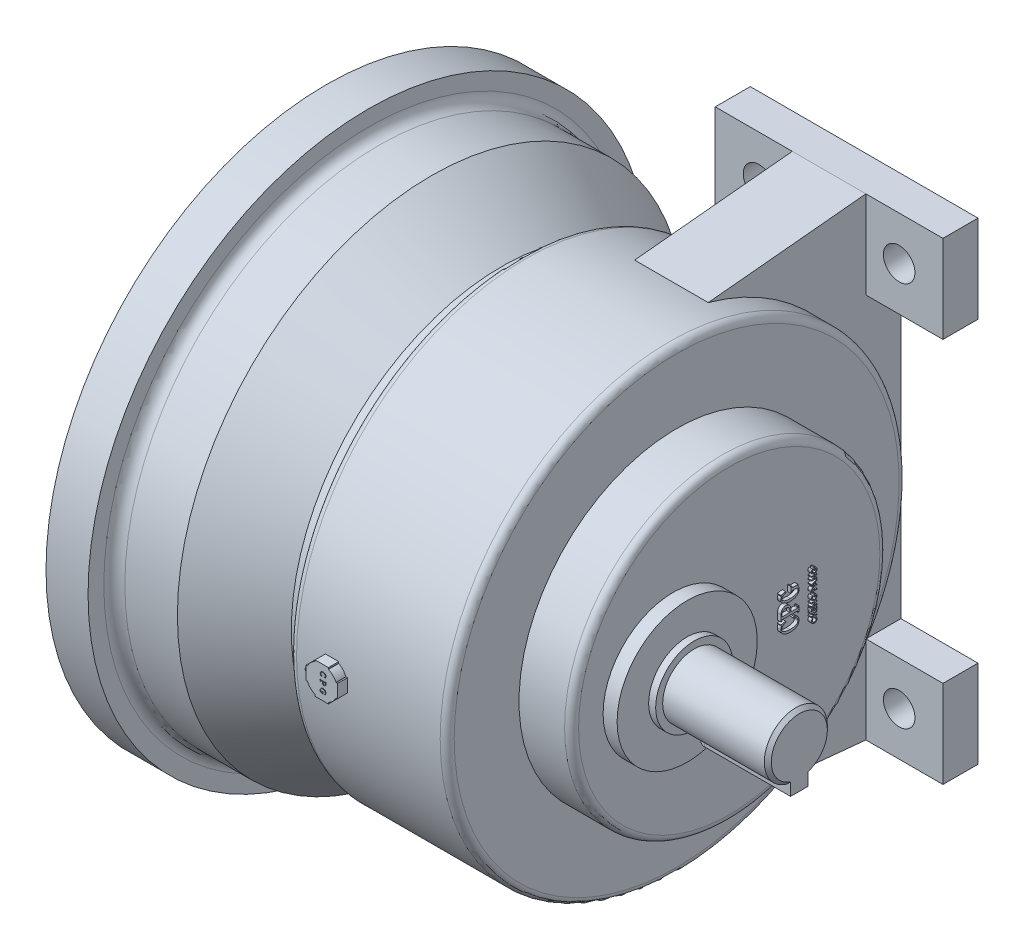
SolidWorks part; units mm, degrees
ref_plane "前视基准面" through (0, 0, 0) normal (0, 0, 1) x (1, 0, 0)
ref_plane "上视基准面" through (0, 0, 0) normal (0, 1, 0) x (1, 0, 0)
ref_plane "右视基准面" through (0, 0, 0) normal (1, 0, 0) x (0, 0, -1)
ref_plane "基准面1" through (0, 0, -88.5) normal (0, 0, 1) x (1, 0, 0)
sketch "草图1" plane through (0, 0, 0) normal (0, 1, 0) x (1, 0, 0)
  line L0 (0, 0) -> (33.1729, 0) construction
  line L1 (0, 0) -> (0, -9)
  line L2 (0, -9) -> (-30, -9)
  line L3 (-30, -9) -> (-30, -11)
  line L4 (-30, -11) -> (-32, -11)
  line L5 (-32, -11) -> (-32, -20)
  line L6 (-32, -20) -> (-36, -20)
  line L7 (-36, -20) -> (-36, 0)
  line L8 (-36, 0) -> (0, 0)
  dimension "D1" = 30
  dimension "D2" = 18
  dimension "D3" = 22
  dimension "D4" = 2
  dimension "D5" = 40
  dimension "D6" = 4
revolve "旋转1" add sketch "草图1" angle 360 about L0
sketch "草图2" plane through (0, 0, 0) normal (0, 1, 0) x (1, 0, 0)
  line L0 (8.0167, 16) -> (-36, 16) construction
  line L1 (-36, 16) -> (-36, -29)
  line L2 (-36, 20) -> (-36, -20) construction
  line L3 (-36, -29) -> (-51, -29)
  line L4 (-51, -29) -> (-51, -49.5)
  line L5 (-51, -49.5) -> (-96, -49.5)
  line L6 (-96, -49.5) -> (-96, 16)
  line L11 (-36, 16) -> (-96, 16)
  line L13 (-103.125, 88.5) -> (103.125, 88.5) construction
  dimension "D1" = 16
  dimension "D2" = 90
  dimension "D3" = 15
  dimension "D4" = 138
  dimension "D5" = 45
revolve "旋转2" add sketch "草图2" angle 360 about L0
sketch "草图3" plane through (0, 0, -88.5) normal (0, 0, 1) x (1, 0, 0)
  line L0 (0, 0) -> (40.0459, 0) construction
  line L1 (-102.5, -42.5) -> (-37.5, -42.5)
  line L2 (-102.5, -42.5) -> (-102.5, -67.5)
  line L3 (-102.5, -67.5) -> (-37.5, -67.5)
  line L4 (-37.5, -42.5) -> (-37.5, -67.5)
  line L5 (0, -9) -> (0, 9) construction
  circle A0 centre (-50, -55) radius 4.5
  circle A1 centre (-90, -55) radius 4.5
  dimension "D2" = 110
  dimension "D3" = 9
  dimension "D4" = 40
  dimension "D6" = 50
  dimension "D8" = 25
  dimension "D1" = 135
  dimension "D5" = 65
  dimension "D7" = 12.5
extrude "拉伸2" add sketch "草图3" along normal blind 10
mirror "镜向2" about plane through (0, 0, 0) normal (0, 1, 0)
ref_plane "基准面4" through (-70, 0, 0) normal (1, 0, 0) x (0, 0, -1)
sketch "草图4" plane through (-70, 0, 0) normal (1, 0, 0) x (0, 0, -1)
  line L0 (78.5, 42.5) -> (88.5, 42.5) construction
  line L1 (78.5, 42.5) -> (88.5, 42.5)
  line L2 (78.5, 67.5) -> (78.5, 42.5) construction
  line L3 (78.5, 67.5) -> (78.5, 42.5)
  line L4 (78.5, -42.5) -> (88.5, -42.5) construction
  line L5 (78.5, -42.5) -> (88.5, -42.5)
  line L6 (78.5, -67.5) -> (78.5, -42.5) construction
  line L7 (78.5, -67.5) -> (78.5, -42.5)
  line L8 (88.5, 42.5) -> (88.5, -42.5)
  line L9 (78.5, 67.5) -> (33.5, 63.1189)
  line L11 (33.5, -63.1189) -> (78.5, -67.5)
  arc A1 (33.5, -63.1189) -> (33.5, 63.1189) centre (16, 0) ccw
  circle A2 centre (16, 0) radius 65.5 construction
  dimension "D1" = 45
extrude "拉伸3" add sketch "草图4" against normal mid plane 21
sketch "草图5" plane through (0, 0, 0) normal (0, 1, 0) x (1, 0, 0)
  line L0 (0, -2.5) -> (-24.5, -2.5)
  line L1 (0, -9) -> (0, 9) construction
  line L2 (-24.5, 2.5) -> (0, 2.5)
  line L3 (0, 2.5) -> (0, -2.5)
  line L4 (20.2, -13.7955) -> (20.2, 19.6443) construction
  arc A0 (-24.5, -2.5) -> (-24.5, 2.5) centre (-24.5, 0) cw
  dimension "D2" = 27
  dimension "D1" = 5
  dimension "D3" = 20.2
extrude "拉伸4" add sketch "草图5" against normal blind 11.2
fillet "圆角1" radius 2 3 edges at (-96, 0, -81.5) (-51, 0, -81.5) (-36, 0, -61)
chamfer "倒角1" distance 1 angle 45 1 edges at (0, 9, 0)
ref_plane "BOX ANGLE" through (0, 0, 0) normal (0, 1, 0) x (-1, 0, 0)
sketch "草圖2"
extrude "伸長1" add sketch "草圖2" along normal blind 1
sketch "草圖4" plane through (0, 0, 0) normal (0, 1, 0) x (1, 0, 0)
  line L0 (-96, 16) -> (-143.5, 16)
  line L1 (-96, -44) -> (-96, 16)
  line L2 (-15.3334, 16) -> (-187.5704, 16) construction
  line L4 (-96, -44) -> (-101, -44)
  line L5 (-101, -44) -> (-121, -56.5)
  line L6 (-121, -56.5) -> (-136, -56.5)
  line L7 (-139, -59.5) -> (-139, -64)
  line L8 (-139, -64) -> (-151, -64)
  line L9 (-151, -64) -> (-151, -40)
  line L10 (-150, -39) -> (-147, -39)
  line L11 (-147, -39) -> (-147, -34.0871)
  line L12 (-126, -23.5606) -> (-126, -18)
  line L13 (-129, -15) -> (-144, -15)
  line L14 (-145, -14) -> (-145, -5)
  line L15 (-145, -5) -> (-143.8, -5)
  line L16 (-143.5, -4.7) -> (-143.5, 16)
  line L17 (-146.9137, -33.988) -> (-126, -31.0869)
  arc A0 (-136, -56.5) -> (-139, -59.5) centre (-136, -59.5) ccw
  arc A1 (-126, -31.0869) -> (-124.7461, -26.0001) centre (-126.3875, -28.2934) ccw
  arc A2 (-150, -39) -> (-151, -40) centre (-150, -40) ccw
  arc A3 (-146.9137, -33.988) -> (-147, -34.0871) centre (-146.9, -34.0871) ccw
  arc A4 (-124.7461, -26.0001) -> (-126, -23.5606) centre (-123, -23.5606) cw
  arc A5 (-126, -18) -> (-129, -15) centre (-129, -18) ccw
  arc A6 (-144, -15) -> (-145, -14) centre (-144, -14) cw
  arc A7 (-143.8, -5) -> (-143.5, -4.7) centre (-143.8, -4.7) ccw
  point P27 (-151, -39)
  point P30 (-147, -34)
  point P33 (-126, -25.5)
  point P38 (-145, -15)
  point P41 (-145, -4)
  dimension "D9" = 160
  dimension "D18" = 1.5
  dimension "D19" = 16
  dimension "D2" = 120
  dimension "D3" = 55
  dimension "D8" = 145
  dimension "D10" = 110
  dimension "D11" = 4
  dimension "D16" = 6
  dimension "D17" = 30
revolve "旋轉1" add sketch "草圖4" angle 360 about L2
sketch "草圖5" plane through (-151, 0, 0) normal (-1, 0, 0) x (0, 0, 1)
  line L1 (-16, 84.2191) -> (-16, 0) construction
  line L2 (-16, 0) -> (72.8288, 0) construction
  circle A0 centre (-16, 0) radius 65 construction
  circle A1 centre (-61.9619, 45.9619) radius 4
  circle A2 centre (29.9619, 45.9619) radius 4
  circle A3 centre (29.9619, -45.9619) radius 4
  circle A4 centre (-61.9619, -45.9619) radius 4
  dimension "D1" = 130
  dimension "D2" = 8
extrude "伸長2" cut sketch "草圖5" against normal blind 25
sketch "草圖6" plane through (-151, 0, 0) normal (-1, 0, 0) x (0, 0, 1)
  line L0 (-56.1598, 10.4613) -> (-63.2309, 17.5324)
  line L1 (-62.4923, 34.825) -> (-50.825, 46.4923)
  line L4 (-41.5138, -60.8691) -> (-21.2608, -41.1652)
  line L23 (31.2309, 17.5324) -> (24.1598, 10.4613)
  line L24 (-76.8691, -25.5138) -> (-57.1013, -5.739)
  line L34 (-33.5324, 47.2309) -> (-26.4613, 40.1598)
  line L35 (-41.5138, 60.8691) -> (-21.739, 41.1013)
  line L36 (24.1598, -10.4613) -> (31.2309, -17.5324)
  line L37 (-76.8691, 25.5138) -> (-57.1652, 5.2608)
  line L38 (9.5138, 60.8691) -> (-10.7392, 41.1652)
  line L39 (44.8691, 25.5138) -> (25.1013, 5.739)
  line L40 (-26.4613, -40.1598) -> (-33.5324, -47.2309)
  line L41 (44.8691, -25.5138) -> (25.1652, -5.2608)
  line L42 (1.5324, -47.2309) -> (-5.5387, -40.1598)
  line L43 (-5.5387, 40.1598) -> (1.5324, 47.2309)
  line L44 (-50.825, -46.4923) -> (-62.4923, -34.825)
  line L45 (30.4923, -34.825) -> (18.825, -46.4923)
  line L46 (18.825, 46.4923) -> (30.4923, 34.825)
  line L47 (9.5138, -60.8691) -> (-10.261, -41.1013)
  line L48 (-63.2309, -17.5324) -> (-56.1598, -10.4613)
  arc A17 (-76.8691, 25.5138) -> (-76.8691, -25.5138) centre (-16, 0) ccw
  arc A18 (-26.4613, 40.1598) -> (-56.1598, 10.4613) centre (-16, 0) ccw
  arc A19 (24.1598, 10.4613) -> (-5.5387, 40.1598) centre (-16, 0) ccw
  arc A20 (25.1652, -5.2608) -> (25.1013, 5.739) centre (-16, 0) ccw
  arc A21 (-41.5138, -60.8691) -> (9.5138, -60.8691) centre (-16, 0) ccw
  arc A22 (-21.2608, -41.1652) -> (-10.261, -41.1013) centre (-16, 0) ccw
  arc A23 (-57.1652, 5.2608) -> (-57.1013, -5.739) centre (-16, 0) ccw
  arc A24 (9.5138, 60.8691) -> (-41.5138, 60.8691) centre (-16, 0) ccw
  arc A25 (-5.5387, -40.1598) -> (24.1598, -10.4613) centre (-16, 0) ccw
  arc A26 (44.8691, -25.5138) -> (44.8691, 25.5138) centre (-16, 0) ccw
  arc A27 (-56.1598, -10.4613) -> (-26.4613, -40.1598) centre (-16, 0) ccw
  arc A28 (-10.7392, 41.1652) -> (-21.739, 41.1013) centre (-16, 0) ccw
  spline S8 degree 2 poles (-33.5324, -47.2309) (-42.3941, -52.0713) (-50.825, -46.4923) knots 0 0 0 1 1 1
  spline S9 degree 2 poles (-63.2309, 17.5324) (-68.0713, 26.3941) (-62.4923, 34.825) knots 0 0 0 1 1 1
  spline S10 degree 2 poles (31.2309, -17.5324) (36.0713, -26.3941) (30.4923, -34.825) knots 0 0 0 1 1 1
  spline S11 degree 2 poles (-63.2309, -17.5324) (-68.0713, -26.3941) (-62.4923, -34.825) knots 0 0 0 1 1 1
  spline S12 degree 2 poles (-33.5324, 47.2309) (-42.3941, 52.0713) (-50.825, 46.4923) knots 0 0 0 1 1 1
  spline S13 degree 2 poles (31.2309, 17.5324) (36.0713, 26.3941) (30.4923, 34.825) knots 0 0 0 1 1 1
  spline S14 degree 2 poles (1.5324, 47.2309) (10.3941, 52.0713) (18.825, 46.4923) knots 0 0 0 1 1 1
  spline S15 degree 2 poles (1.5324, -47.2309) (10.3941, -52.0713) (18.825, -46.4923) knots 0 0 0 1 1 1
  dimension "D1" = 41.5
  dimension "D2" = 66
extrude "伸長3" cut sketch "草圖6" against normal blind 39 draft 1
sketch "草圖7" plane through (-112, 0, 0) normal (-1, 0, 0) x (0, 0, 1)
  circle A0 centre (-16, 0) radius 51.5 construction
  circle A1 centre (-52.416, 36.416) radius 3
  circle A2 centre (20.416, 36.416) radius 3
  circle A3 centre (20.416, -36.416) radius 3
  circle A4 centre (-52.416, -36.416) radius 3
  dimension "D1" = 103
  dimension "D2" = 6
extrude "伸長4" cut sketch "草圖7" against normal blind 11
sketch "草圖8" plane through (-143.5, 0, 0) normal (-1, 0, 0) x (0, 0, 1)
  line L0 (-16, -16.5253) -> (-16, 16) construction
  line L3 (-33.7414, 0) -> (0.5842, 0) construction
  line L5 (-8.7, 2) -> (-8.7, -2)
  line L6 (-8.7, -2) -> (-10.8765, -2)
  line L7 (-8.7, 2) -> (-10.8765, 2)
  circle A0 centre (-16, 0) radius 12.5 construction
  arc A1 (-10.8765, 2) -> (-10.8765, -2) centre (-16, 0) ccw
  dimension "D1" = 25
  dimension "D2" = 11
  dimension "D3" = 7.3
  dimension "D4" = 4
extrude "伸長5" cut sketch "草圖8" against normal blind 28
sketch "草圖9" plane through (-143.5, 0, 0) normal (-1, 0, 0) x (0, 0, 1)
  line L0 (-10.8765, -2) -> (-8.7, -2) construction
  line L1 (-8.7, -2) -> (-8.7, 2) construction
  line L2 (-8.7, 2) -> (-10.8765, 2) construction
  line L3 (-10.8765, -2) -> (-8.7, -2)
  line L4 (-8.7, -2) -> (-8.7, 2)
  line L5 (-8.7, 2) -> (-10.8765, 2)
  arc A0 (-10.8765, 2) -> (-10.8765, -2) centre (-16, 0) ccw construction
  arc A1 (-10.8765, 2) -> (-10.8765, -2) centre (-16, 0) ccw
  circle A2 centre (-16, 0) radius 14
  dimension "D1" = 28
extrude "伸長6" add sketch "草圖9" along normal blind 1
ref_plane "平面1" through (0, 0, 52.3) normal (0, 0, 1) x (1, 0, 0)
sketch "草圖10" plane through (0, 0, 52.3) normal (0, 0, 1) x (1, 0, 0)
  line L0 (-85.8947, 4.5) -> (-82.1053, 4.5)
  line L2 (-85.8947, 4.1268) -> (-85.8947, 4.5)
  line L3 (-82.1053, 4.1268) -> (-82.1053, 4.5)
  line L4 (-88.1268, 1.8947) -> (-88.5, 1.8947)
  line L5 (-88.1268, -1.8947) -> (-88.5, -1.8947)
  line L6 (-88.5, -1.8947) -> (-88.5, 1.8947)
  line L7 (-85.8947, -4.1268) -> (-85.8947, -4.5)
  line L8 (-82.1053, -4.1268) -> (-82.1053, -4.5)
  line L9 (-82.1053, -4.5) -> (-85.8947, -4.5)
  line L10 (-79.8732, -1.8947) -> (-79.5, -1.8947)
  line L11 (-79.8732, 1.8947) -> (-79.5, 1.8947)
  line L12 (-79.5, 1.8947) -> (-79.5, -1.8947)
  arc A0 (-85.9352, 4.0626) -> (-88.0626, 1.9352) centre (-84, 0) ccw
  arc A1 (-85.9352, 4.0626) -> (-85.8947, 4.1268) centre (-85.9658, 4.1268) ccw
  arc A2 (-82.1053, 4.1268) -> (-82.0648, 4.0626) centre (-82.0342, 4.1268) ccw
  arc A3 (-88.1268, 1.8947) -> (-88.0626, 1.9352) centre (-88.1268, 1.9658) ccw
  arc A4 (-88.0626, -1.9352) -> (-88.1268, -1.8947) centre (-88.1268, -1.9658) ccw
  arc A5 (-85.8947, -4.1268) -> (-85.9352, -4.0626) centre (-85.9658, -4.1268) ccw
  arc A6 (-82.0648, -4.0626) -> (-82.1053, -4.1268) centre (-82.0342, -4.1268) ccw
  arc A7 (-79.8732, -1.8947) -> (-79.9374, -1.9352) centre (-79.8732, -1.9658) ccw
  arc A8 (-79.9374, 1.9352) -> (-79.8732, 1.8947) centre (-79.8732, 1.9658) ccw
  arc A9 (-88.0626, -1.9352) -> (-85.9352, -4.0626) centre (-84, 0) ccw
  arc A10 (-82.0648, -4.0626) -> (-79.9374, -1.9352) centre (-84, 0) ccw
  arc A11 (-79.9374, 1.9352) -> (-82.0648, 4.0626) centre (-84, 0) ccw
extrude "伸長7" add sketch "草圖10" against normal blind 3
sketch "草圖11"
extrude "伸長8" add sketch "草圖11" along normal blind 0.15
sketch "草圖12" plane through (0, 0, 0) normal (0, 1, 0) x (1, 0, 0)
  line L0 (-88.1166, -51.2828) -> (-86.3784, -51.1863)
  line L1 (-88.8891, -51.2828) -> (-88.1166, -51.2828)
  line L2 (-88.8891, -51.5725) -> (-88.8891, -51.2828)
  line L3 (-89.4685, -51.5725) -> (-89.4685, -50.8)
  line L4 (-89.4685, -51.5725) -> (-88.8891, -51.5725)
  line L5 (-86.3784, -51.1863) -> (-86.3784, -50.8)
  line L6 (-86.3784, -50.8) -> (-89.4685, -50.8)
revolve "旋轉2" add sketch "草圖12" angle 360 about L6
equation "\"D7@草图3\" =  ( \"D5@草图3\"-\"D4@草图3\"  )  / 2"
equation "\"D8@草图3\" =  \"D1@草图3\"-\"D2@草图3\""
equation "\"D1@拉伸4\" =\"D3@草图5\"-\"D2@草图1\"/2"
equation "\"D3@草图1\" = \"D2@草图1\"+4"
equation "\"D5@草图2\" = \"D4@草图3\"+5"
equation "\"D1@基准面4\" =\"D5@草图3\"/2"
equation "\"D1@拉伸3\" = \"D4@草图3\"-\"D3@草图3\" - 10"
